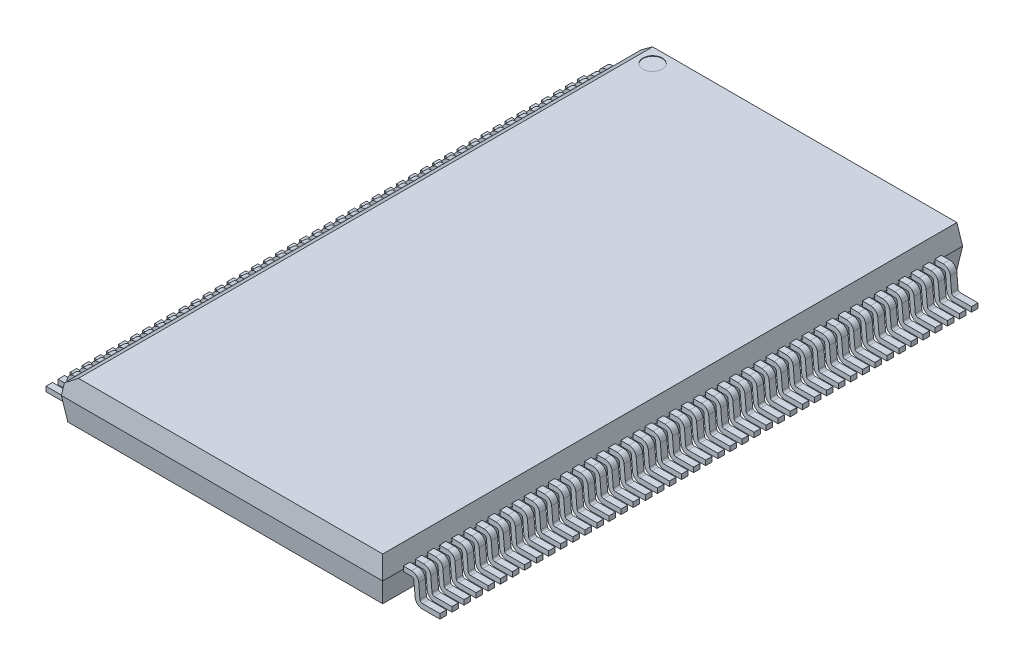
SolidWorks part; units mm, degrees
ref_plane "Front" through (0, 0, 0) normal (0, 0, 1) x (1, 0, 0)
ref_plane "Top" through (0, 0, 0) normal (0, 1, 0) x (1, 0, 0)
ref_plane "Right" through (0, 0, 0) normal (1, 0, 0) x (0, 0, -1)
ref_plane "ПлоскостьВывод1" through (0, 0, -11) normal (0, 0, 1) x (1, 0, 0)
sketch "ЭскизВывод1" plane through (0, 0, -11) normal (0, 0, 1) x (1, 0, 0)
  line L0 (-8.15, 0) -> (-7.4249, 0)
  line L1 (-7.126, 0.2739) -> (-7.0749, 0.8587)
  line L2 (-6.9753, 0.95) -> (6.9753, 0.95)
  line L3 (0, 0.95) -> (0, 0) construction
  line L4 (7.126, 0.2739) -> (7.0749, 0.8587)
  line L5 (8.15, 0) -> (7.4249, 0)
  arc A0 (-7.0749, 0.8587) -> (-6.9753, 0.95) centre (-6.9753, 0.85) cw
  arc A1 (-7.4249, 0) -> (-7.126, 0.2739) centre (-7.4249, 0.3) ccw
  arc A2 (7.4249, 0) -> (7.126, 0.2739) centre (7.4249, 0.3) cw
  arc A3 (7.0749, 0.8587) -> (6.9753, 0.95) centre (6.9753, 0.85) ccw
  point P8 (-7.0669, 0.95)
  point P11 (-7.15, 0)
  dimension "D6" = 0.1
  dimension "D7" = 0.3
  dimension "E" = 16.3
  dimension "A_mid_lead" = 0.95
  dimension "L" = 1
  dimension "D4" = 85
  dimension "D5" = 14.1338
extrude "Вывод1" add sketch "ЭскизВывод1" along normal mid plane 0.27 thin
ref_plane "ПлоскостьКорпус" through (0, 1.05, 0) normal (0, 1, 0) x (-1, 0, 0)
sketch "ЭскизКорпус" plane through (0, 1.05, 0) normal (0, 1, 0) x (1, 0, 0)
  line L1 (6.65, -12) -> (-6.65, -12)
  line L2 (6.65, -12) -> (6.65, 12)
  line L3 (6.65, 12) -> (-6.65, 12)
  line L4 (-6.65, -12) -> (-6.65, 12)
  line L5 (6.65, -12) -> (-6.65, 12) construction
  line L6 (6.65, 12) -> (-6.65, -12) construction
  point P0 (0, 0)
  dimension "D" = 24
  dimension "E" = 13.3
extrude "Корпус" add sketch "ЭскизКорпус" along normal offset from surface 1.9 draft 8 and the other way offset from surface (0.95 mm away) 0.1 draft 8
pattern_linear "Выводы" count 45 spacing 0.5 along (0, 0, 1) of "Вывод1"
chamfer "Фаска1" distance 0.4 angle 45 1 edges at (-6.5305, 1.9, 0)
sketch "Эскиз3" plane through (0, 1.9, 0) normal (0, 1, 0) x (1, 0, 0)
  line L0 (-6.0606, 11.2805) -> (-5.4606, 11.2805) construction
  line L1 (-6.0606, 11.8805) -> (-6.0606, -11.8805) construction
  line L2 (-5.4606, 11.2805) -> (-5.4606, 11.8805) construction
  line L3 (6.5305, 11.8805) -> (-6.0606, 11.8805) construction
  circle A0 centre (-5.4606, 11.2805) radius 0.4
  dimension "D2" = 0.8
  dimension "D1" = 0.6
extrude "Вытянуть3" cut sketch "Эскиз3" against normal blind 0.02
sketch "SkThermalPad" plane through (0, 1.05, 0) normal (0, 1, 0) x (-1, 0, 0)
  line L1 (1.25, 1.25) -> (-1.25, 1.25)
  line L2 (1.25, 1.25) -> (1.25, -1.25)
  line L3 (1.25, -1.25) -> (-1.25, -1.25)
  line L4 (-1.25, 1.25) -> (-1.25, -1.25)
  line L5 (1.25, 1.25) -> (-1.25, -1.25) construction
  line L6 (1.25, -1.25) -> (-1.25, 1.25) construction
  point P0 (0, 0)
  dimension "D1" = 2.5
  dimension "E2" = 2.5
extrude "ThermalPad" [suppressed] add sketch "SkThermalPad" against normal up to surface (0.95 mm away)
